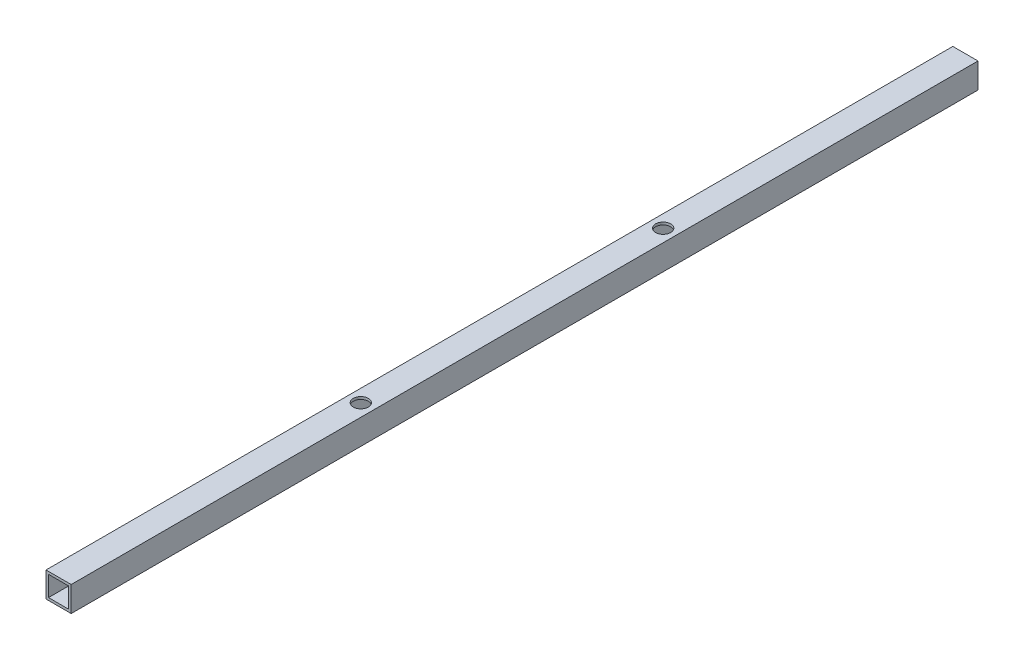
SolidWorks part; units mm, degrees
ref_plane "Alzado" through (0, 0, 0) normal (0, 0, 1) x (1, 0, 0)
ref_plane "Planta" through (0, 0, 0) normal (0, 1, 0) x (1, 0, 0)
ref_plane "Vista lateral" through (0, 0, 0) normal (1, 0, 0) x (0, 0, -1)
sketch "Croquis2" plane through (0, 0, 0) normal (0, 0, 1) x (1, 0, 0)
  line L1 (-5, 5) -> (5, 5)
  line L2 (-5, 5) -> (-5, -5)
  line L3 (-5, -5) -> (5, -5)
  line L4 (5, 5) -> (5, -5)
  line L5 (-5, 5) -> (5, -5) construction
  line L6 (-5, -5) -> (5, 5) construction
  point P0 (0, 0)
  point P6 (0, 0)
  dimension "D1" = 10
  dimension "D2" = 10
extrude "Saliente-Extruir1" add sketch "Croquis2" along normal blind 360
sketch "Croquis3" plane through (0, 0, 360) normal (0, 0, 1) x (1, 0, 0)
  line L1 (-4, 4) -> (4, 4)
  line L2 (-4, 4) -> (-4, -4)
  line L3 (-4, -4) -> (4, -4)
  line L4 (4, 4) -> (4, -4)
  line L5 (-4, 4) -> (4, -4) construction
  line L6 (-4, -4) -> (4, 4) construction
  point P0 (0, 0)
  dimension "D1" = 8
  dimension "D2" = 8
extrude "Cortar-Extruir1" cut sketch "Croquis3" against normal blind 360
sketch "Croquis4" plane through (0, 5, 0) normal (0, 1, 0) x (1, 0, 0)
  line L0 (0, 0) -> (0, -360) construction
  line L1 (5, -360) -> (-5, -360) construction
  line L2 (-5, -180) -> (5, -180) construction
  line L3 (-5, -360) -> (-5, 0) construction
  line L4 (5, -360) -> (5, 0) construction
  circle A0 centre (0, -120) radius 3
  circle A1 centre (0, -240) radius 3
  dimension "D1" = 6
  dimension "D3" = 6
  dimension "D2" = 60
  dimension "D4" = 60
extrude "Cortar-Extruir2" cut sketch "Croquis4" against normal up to next
